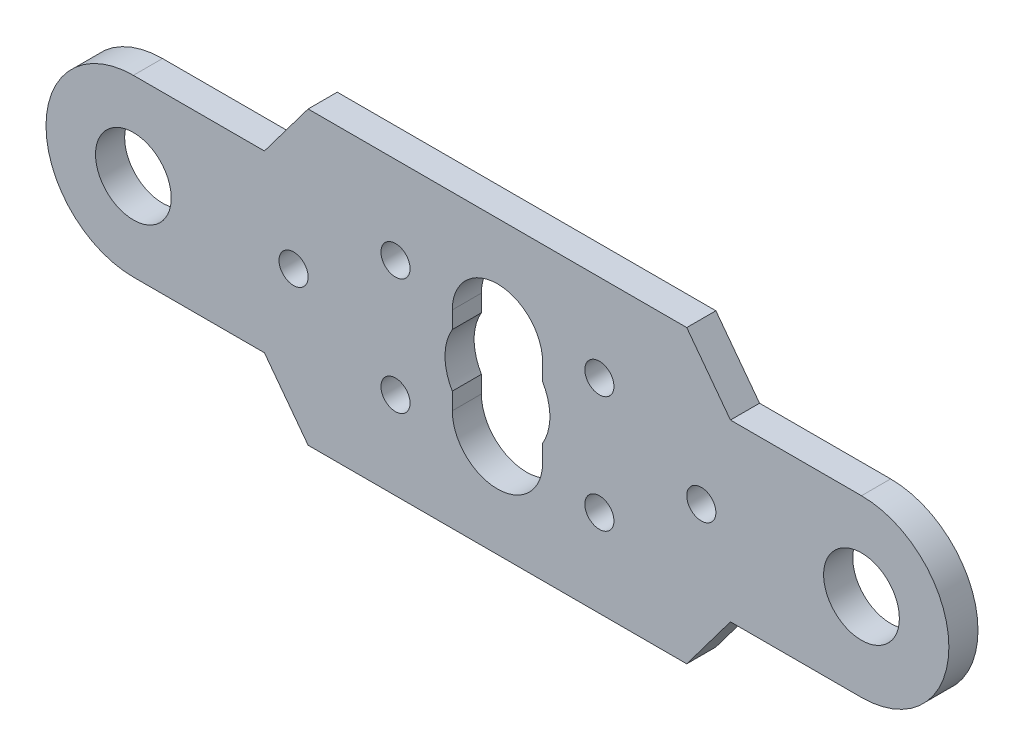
SolidWorks part; units mm, degrees
ref_plane "Face" through (0, 0, 0) normal (0, 0, 1) x (1, 0, 0)
ref_plane "Dessus" through (0, 0, 0) normal (0, 1, 0) x (1, 0, 0)
ref_plane "Droite" through (0, 0, 0) normal (1, 0, 0) x (0, 0, -1)
sketch "Esquisse1" plane through (0, 0, 0) normal (0, 0, 1) x (1, 0, 0)
  line L0 (0, 0) -> (0, 5)
  line L1 (0, 5) -> (6.5, 5)
  line L2 (6.5, 5) -> (8, 3)
  line L3 (8, 3) -> (12.5, 3)
  line L4 (0, 0) -> (15.5, 0)
  arc A0 (12.5, 3) -> (15.5, 0) centre (12.5, 0) cw
  dimension "D1" = 3
  dimension "D2" = 15.5
  dimension "D3" = 6.5
  dimension "D4" = 8
  dimension "D5" = 5
extrude "Extrusion1" add sketch "Esquisse1" along normal blind 1
sketch "Esquisse2" plane through (0, 0, 1) normal (0, 0, 1) x (1, 0, 0)
  line L0 (0, 0) -> (15.5, 0) construction
  line L1 (1.55, 1.5) -> (1.55, 0.9152)
  line L5 (0, 5) -> (0, 0) construction
  circle A0 centre (12.5, 0) radius 1.3
  arc A1 (1.55, 1.5) -> (-1.4768, 1.0292) centre (0, 1.5) ccw
  circle A2 centre (7, 0) radius 0.5
  arc A3 (-1.4768, 1.0292) -> (1.55, 0.9152) centre (0, 0) ccw
  circle A4 centre (3.5, 2) radius 0.5
  dimension "D1" = 2.6
  dimension "D2" = 1
  dimension "D5" = 3.6
  dimension "D3" = 1.55
  dimension "D7" = 1
  dimension "D4" = 1.5
  dimension "D6" = 7
  dimension "D8" = 2
  dimension "D9" = 3.5
extrude "Extrusion2" cut sketch "Esquisse2" against normal through all
mirror "Symétrie1" about plane through (0, 0, 1) normal (0, 1, 0)
mirror "Symétrie2" about plane through (0, 0, 1) normal (1, 0, 0)
